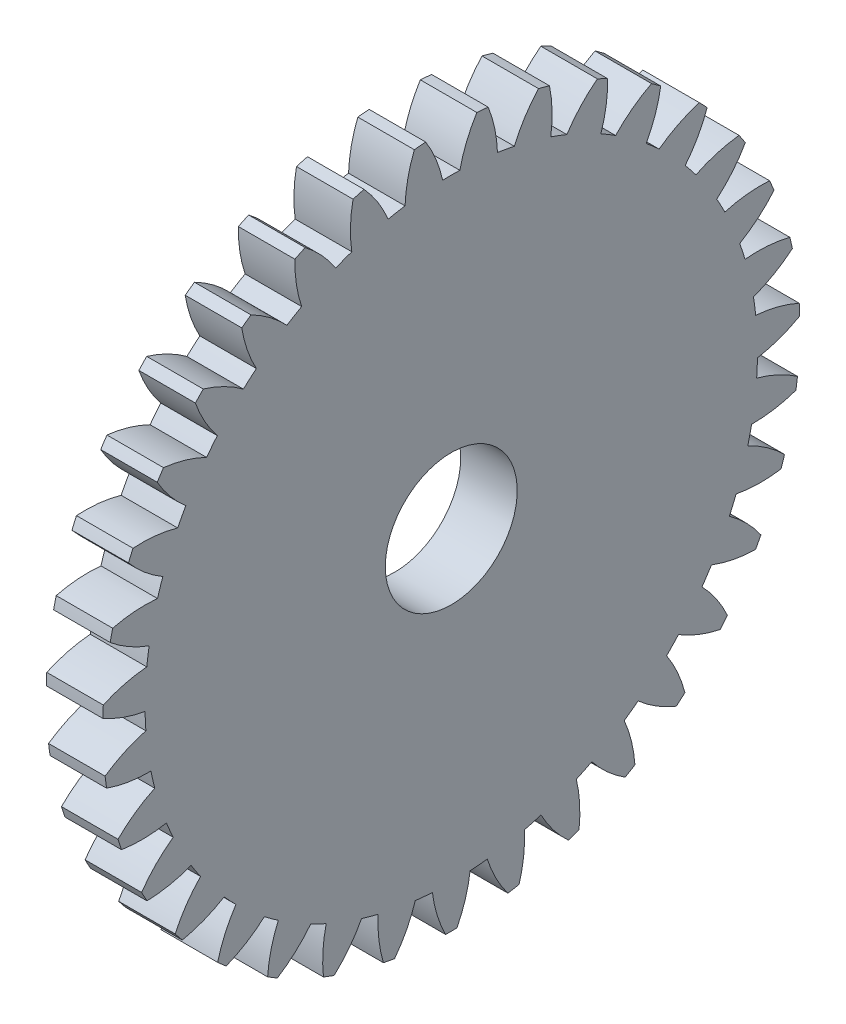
SolidWorks part; units mm, degrees
ref_plane "Plane1" through (0, 0, 0) normal (0, 0, 1) x (1, 0, 0)
ref_plane "Plane2" through (0, 0, 0) normal (0, 1, 0) x (1, 0, 0)
ref_plane "Plane3" through (0, 0, 0) normal (1, 0, 0) x (0, 0, -1)
sketch "HoldingSke" plane through (0, 0, 0) normal (0, 1, 0) x (1, 0, 0)
  line L0 (0, 0) -> (0.8192, -0.5736)
  line L1 (-15, 0) -> (100, 0) construction
  line L2 (0, 0) -> (-2.1039, 2.3779)
  line L3 (0, 0) -> (-11.863, 4.5341)
  line L4 (0, 0) -> (7.0742, 4.9534)
  line L5 (0, 0) -> (-46.8476, -17.4728)
  line L6 (0, 0) -> (-2.4869, -1.6779)
  line L7 (-2.1039, 2.3779) -> (8.6586, 51.2059)
  line L8 (-76.2, 54.61) -> (-75.2, 54.61)
  line L9 (-71.009, 38.7566) -> (-53.1078, 45.2721)
  line L10 (-76.2, 71.12) -> (104.1128, 71.12)
  line L11 (0, 0) -> (-3, 0)
  line L12 (-76.2, 101.6) -> (-76.162, 101.6)
  line L13 (24.9733, 27.94) -> (52.9518, 28.4284)
  line L14 (24.9733, 27.94) -> (24.9743, 27.94)
  line L15 (24.9733, 27.94) -> (100.4006, 29.5858)
  line L16 (-63.627, -1) -> (-12.827, -1)
  circle A0 centre (0, 0) radius 3.5
  circle A1 centre (0, 0) radius 16.249
  circle A2 centre (0, 0) radius 37.5
  circle A3 centre (0, 0) radius 3.5
sketch "BasProSke" plane through (0, 0, 0) normal (0, 1, 0) x (1, 0, 0)
  line L0 (-10, 0) -> (60, 0) construction
  line L1 (0, 0) -> (0, 18.5)
  line L2 (0, 0) -> (3, 0)
  line L3 (3, 0) -> (3, 18.5)
  line L4 (3, 18.5) -> (0, 18.5)
revolve "Base-Revolve" add sketch "BasProSke" angle 360 about L0
sketch "TooCutSke" plane through (0, 0, 0) normal (1, 0, 0) x (0, 0, -1)
  line L1 (0, 0) -> (0, 107) construction
  line L2 (0, 0) -> (-0.8516, 17.4793) construction
  line L3 (0, 0) -> (-3.1347, 34.8297) construction
  line L4 (-0.8516, 17.4793) -> (-1.5674, 17.4148) construction
  arc A0 (0.4564, 16.2426) -> (-0.4564, 16.2426) centre (0, 0) ccw
  arc A1 (1.373, 18.4745) -> (-1.373, 18.4745) centre (0, 0) ccw
  circle A2 centre (0, 0) radius 17.5 construction
  circle A3 centre (0, 0) radius 16.4446 construction
  arc A4 (-0.4564, 16.2426) -> (-1.373, 18.4745) centre (-7.293, 14.739) ccw
  arc A5 (1.373, 18.4745) -> (0.4564, 16.2426) centre (7.293, 14.739) ccw
extrude "ToothCut" cut sketch "TooCutSke" along normal through all
fillet "Breaks" [suppressed] radius 0.02
fillet "RootFillets" [suppressed] radius 0.251
pattern_circular "TeethCuts" count 35 every 10.286 about axis through (-10, 0, 0) along (1, 0, 0) of "ToothCut", "RootFillets", "Breaks"
sketch "HubNeaOneSke" plane through (0, 0, 0) normal (-1, 0, 0) x (0, 0, 1)
  circle A0 centre (0, 0) radius 16.249
extrude "HubNearOne" [suppressed] add sketch "HubNeaOneSke" along normal blind 47.0001
sketch "HubNeaBotSke" plane through (0, 0, 0) normal (-1, 0, 0) x (0, 0, 1)
  circle A0 centre (0, 0) radius 16.249
extrude "HubNearBoth" [suppressed] add sketch "HubNeaBotSke" along normal blind 23.5
ref_plane "FarPln" through (3, 0, 0) normal (1, 0, 0) x (0, 0, -1)
sketch "HubFarSke" plane through (3, 0, 0) normal (1, 0, 0) x (0, 0, -1)
  circle A0 centre (0, 0) radius 16.249
extrude "HubFar" [suppressed] add sketch "HubFarSke" along normal blind 23.5
sketch "BorSke" plane through (0, 0, 0) normal (1, 0, 0) x (0, 0, -1)
  circle A0 centre (0, 0) radius 3.5
extrude "Bore" cut sketch "BorSke" along normal mid plane 100.0001
sketch "KeySke" plane through (0, 0, 0) normal (1, 0, 0) x (0, 0, -1)
  line L0 (-1, 0) -> (-1, 4.5)
  line L1 (-1, 4.5) -> (1, 4.5)
  line L2 (1, 4.5) -> (1, 0)
  line L3 (0, 0) -> (0, 34) construction
  line L4 (-1, 0) -> (1, 0)
extrude "Keyway" [suppressed] cut sketch "KeySke" along normal mid plane 100.0001
pattern_circular "Keyway2" [suppressed] count 2 every 90 about axis through (-10, 0, 0) along (1, 0, 0)
equation "' \"Module@HoldingSke\" = 6.35"
equation "' \"Num_teeth@HoldingSke\" = 12"
equation "' \"Ap@HoldingSke\" =  20"
equation "' \"Ap@HoldingSke\" = 20"
equation "' \"Width@HoldingSke\" = 0.5 * 25.4"
equation "' \"Hub_dia@HoldingSke\"= 1 * 25.4"
equation "' \"Hub_dia@HoldingSke\" = 1 * 25.4"
equation "' \"Overall_len@HoldingSke\" = 1.0 * 25.4"
equation "' \"Bore@HoldingSke\" = 0.75 * 25.4"
equation "' \"T_dim@HoldingSke\" = 0.1 * 25.4"
equation "' \"Width@KeySke\" = 0.25 * 25.4"
equation "' \"Show_teeth@HoldingSke\" = 13"
equation "' \"Backlash@HoldingSke\" = 0.009 * 25.4"
equation "' \"Addendum_fac@HoldingSke\" = 1.0"
equation "' \"Dedendum_fac@HoldingSke\" = 1.25"
equation "' \"Dedendum_add@HoldingSke\" = 0.00005 * 25.4"
equation "' \"Clearance_fac@HoldingSke\" = 0.25"
equation "\"Pitch@HoldingSke\" = 1 / \"Module@HoldingSke\""
equation "\"Overcut_dia@TooCutSke\" = (\"Num_teeth@HoldingSke\" + 2 * \"Addendum_fac@HoldingSke\") / \"Pitch@HoldingSke\" + 0.002 * 25.4"
equation "\"Pitch_dia@TooCutSke\" = \"Num_teeth@HoldingSke\" / \"Pitch@HoldingSke\""
equation "\"Base_dia@TooCutSke\" = \"Num_teeth@HoldingSke\" / \"Pitch@HoldingSke\" * cos((\"Ap@HoldingSke\"  * 3.14159265 / 180))"
equation "\"Root_dia@TooCutSke\" = (\"Num_teeth@HoldingSke\" + 2) / \"Pitch@HoldingSke\" - 2 * (\"Addendum_fac@HoldingSke\" + \"Dedendum_fac@HoldingSke\") / \"Pitch@HoldingSke\" - \"Dedendum_add@HoldingSke\" * 2"
equation "\"Half_ang@TooCutSke\" = 180 / \"Num_teeth@HoldingSke\""
equation "\"Half_CT@TooCutSke\" = \"Num_teeth@HoldingSke\" / \"Pitch@HoldingSke\" * sin((3.14159265 / 2 / \"Num_teeth@HoldingSke\")) / 2 - 7 * \"Backlash@HoldingSke\" / 4"
equation "\"Flank_rad@TooCutSke\" = \"Num_teeth@HoldingSke\" / \"Pitch@HoldingSke\" / 5"
equation "\"Radius@RootFillets\" = \"Clearance_fac@HoldingSke\" / \"Pitch@HoldingSke\" + \"Dedendum_add@HoldingSke\""
equation "\"Break_rad@Breaks\" = 0.02 / \"Pitch@HoldingSke\""
equation "\"Thickness@HoldingSke\" = \"Width@HoldingSke\""
equation "\"OAL@HoldingSke\" = \"Thickness@HoldingSke\""
equation "\"MHD@HoldingSke\" = (\"Num_teeth@HoldingSke\" + 2) / \"Pitch@HoldingSke\" - 2 * (\"Addendum_fac@HoldingSke\" + \"Dedendum_fac@HoldingSke\")  / \"Pitch@HoldingSke\" - \"Dedendum_add@HoldingSke\" * 2"
equation "\"MBD@HoldingSke\" = (\"Num_teeth@HoldingSke\" + 2) / \"Pitch@HoldingSke\" - 2 * (\"Addendum_fac@HoldingSke\" + \"Dedendum_fac@HoldingSke\")  / \"Pitch@HoldingSke\" - \"Dedendum_add@HoldingSke\" * 2 - 0.002 * 25.4"
equation "\"MHD@HoldingSke\" = ((sgn( \"MHD@HoldingSke\" - \"Hub_dia@HoldingSke\" )-1)*( \"MHD@HoldingSke\" - \"Hub_dia@HoldingSke\" ))/-2+ \"Hub_dia@HoldingSke\""
equation "\"MBD@HoldingSke\" = ((sgn( \"MBD@HoldingSke\" - \"Bore@HoldingSke\" )-1)*( \"MBD@HoldingSke\" - \"Bore@HoldingSke\" ))/-2+ \"Bore@HoldingSke\""
equation "\"OAL@HoldingSke\" = ((sgn( \"OAL@HoldingSke\" - \"Overall_len@HoldingSke\" )+1)*( \"OAL@HoldingSke\" - \"Overall_len@HoldingSke\" ))/2 + \"Overall_len@HoldingSke\" + 0.000002 * 25.4"
equation "\"Num_teeth@TeethCuts\" = int( \"Show_teeth@HoldingSke\" ) + 1"
equation "\"Num_teeth@TeethCuts\" = ((sgn( \"Num_teeth@TeethCuts\" - \"Num_teeth@HoldingSke\" )-1)*( \"Num_teeth@TeethCuts\" - \"Num_teeth@HoldingSke\" ))/-2+ \"Num_teeth@HoldingSke\""
equation "\"Num_teeth@TeethCuts\" = ((sgn( \"Num_teeth@TeethCuts\" - 2.0)+1)*( \"Num_teeth@TeethCuts\" - 2.0))/2 +2.0"
equation "\"Angle@TeethCuts\" = 360.0 / \"Num_teeth@HoldingSke\""
equation "\"Diameter@BasProSke\" = (\"Num_teeth@HoldingSke\" + 2 * \"Addendum_fac@HoldingSke\") / \"Pitch@HoldingSke\""
equation "\"Thickness@BasProSke\"  = \"Thickness@HoldingSke\""
equation "' \"Fillet_rad@BasProSke\" =  \"Thickness@HoldingSke\" * 0.05"
equation "' \"Fillet_rad@BasProSke\" = \"Thickness@HoldingSke\" * 0.05"
equation "\"MHD@HoldingSke\" = ((sgn( \"MHD@HoldingSke\" - \"Root_dia@TooCutSke\" )-1)*( \"MHD@HoldingSke\" - \"Root_dia@TooCutSke\" ))/-2+ \"Root_dia@TooCutSke\""
equation "\"Diameter@HubNeaOneSke\" = \"MHD@HoldingSke\""
equation "\"Length@HubNearOne\" = \"OAL@HoldingSke\" - \"Thickness@BasProSke\""
equation "\"Diameter@HubNeaBotSke\" = \"MHD@HoldingSke\""
equation "\"Length@HubNearBoth\" = ( \"OAL@HoldingSke\" - \"Thickness@BasProSke\" ) / 2.0"
equation "\"Thickness@FarPln\" = \"Thickness@BasProSke\""
equation "\"Diameter@HubFarSke\" = \"MHD@HoldingSke\""
equation "\"Length@HubFar\" = ( \"OAL@HoldingSke\" - \"Thickness@BasProSke\" ) / 2.0"
equation "\"Diameter@BorSke\" = \"MBD@HoldingSke\""
equation "\"D1@Bore\" = \"OAL@HoldingSke\" * 2.0"
equation "\"D1@Keyway\" = \"OAL@HoldingSke\" * 2.0"
equation "\"Offset@KeySke\" = \"T_dim@HoldingSke\" + \"MBD@HoldingSke\" / 2.0"
